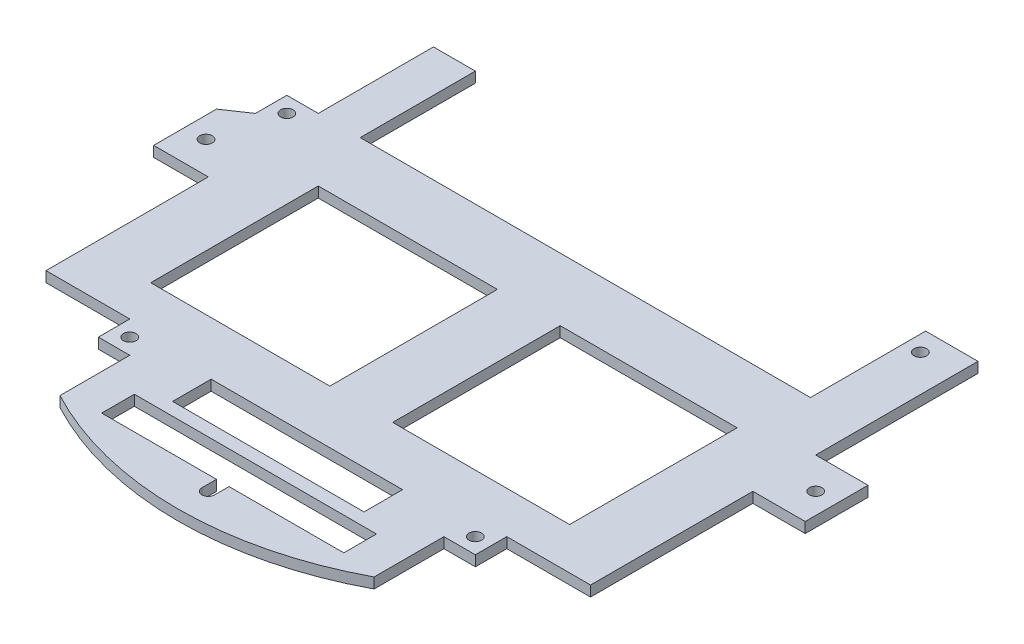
SolidWorks part; units mm, degrees
ref_plane "Ebene vorne" through (0, 0, 0) normal (0, 0, 1) x (1, 0, 0)
ref_plane "Ebene oben" through (0, 0, 0) normal (0, 1, 0) x (1, 0, 0)
ref_plane "Ebene rechts" through (0, 0, 0) normal (1, 0, 0) x (0, 0, -1)
sketch "Skizze1" plane through (0, 0, 0) normal (0, 1, 0) x (1, 0, 0)
  line L0 (-130, 92.5) -> (130, -92.5) construction
  line L1 (-130, 92.5) -> (-110, 92.5)
  line L2 (-130, 92.5) -> (-130, 37.5)
  line L3 (-130, -92.5) -> (-90, -92.5)
  line L4 (130, 92.5) -> (130, 41.1968)
  line L5 (105, 92.5) -> (130, 92.5)
  line L6 (-130, -92.5) -> (130, 92.5) construction
  line L7 (-110, 92.5) -> (-110, 62.6177)
  line L8 (-90, 37.5) -> (90, 37.5)
  line L9 (105, 92.5) -> (105, 57.5)
  line L10 (-130, 37.5) -> (-145, 37.5)
  line L11 (-110, 62.6177) -> (-110, 37.5)
  line L12 (-110, 37.5) -> (-90, 37.5)
  line L13 (45.7, -97.963) -> (-45.7, -97.963)
  line L14 (-75, -133.7259) -> (75, -133.7259) construction
  line L15 (105, 57.5) -> (105, 37.5)
  line L16 (105, 37.5) -> (90, 37.5)
  line L17 (15.5205, -72.5) -> (100, -72.5)
  line L18 (-3, -145.027) -> (-3, -138.1106)
  line L19 (-145, 37.5) -> (-145, 22.5)
  line L20 (155, -15) -> (155, 15)
  line L21 (-130, 22.5) -> (-145, 37.5) construction
  line L22 (-14.4795, 7.5) -> (-14.4795, -72.5)
  line L23 (15.5205, 7.5) -> (100, 7.5)
  line L24 (-130, -15) -> (-130, -92.5)
  line L25 (90, -92.5) -> (90, -107.5)
  line L26 (90, -107.5) -> (75, -107.5)
  line L27 (75, -140.8235) -> (75, -107.5)
  line L28 (90, -92.5) -> (130, -92.5)
  line L29 (-90, -92.5) -> (-90, -107.5)
  line L30 (-90, -107.5) -> (-75, -107.5)
  line L31 (-75, -140.8235) -> (-75, -107.5)
  line L32 (3, -145.027) -> (3, -138.1106)
  line L33 (15.5205, 7.5) -> (15.5205, -72.5)
  line L34 (75, -107.5) -> (90, -92.5) construction
  line L35 (-75, -107.5) -> (-90, -92.5) construction
  line L36 (130, -92.5) -> (130, -15)
  line L37 (-156.0879, -15) -> (-130, -15)
  line L38 (57.8, -122.5106) -> (-57.8, -122.5106)
  line L39 (-156.0879, -15) -> (-156.0879, 15)
  line L40 (3, -138.1106) -> (57.8, -138.1106)
  line L41 (130, 15) -> (130, 41.1968)
  line L42 (155, -15) -> (130, -15)
  line L43 (-156.0879, 15) -> (-145, 22.5)
  line L44 (155, 15) -> (130, 15)
  line L45 (-57.8, -122.5106) -> (-57.8, -138.1106)
  line L46 (0, 0) -> (169.2613, 0) construction
  line L47 (0, 0) -> (-130, 0) construction
  line L48 (-57.8, -138.1106) -> (-3, -138.1106)
  line L49 (-57.8, -138.1106) -> (57.8, -138.1106) construction
  line L53 (-100, 7.5) -> (-14.4795, 7.5)
  line L54 (-100, 7.5) -> (-100, -72.5)
  line L55 (-100, -72.5) -> (-14.4795, -72.5)
  line L56 (100, 7.5) -> (100, -72.5)
  line L57 (57.8, -138.1106) -> (57.8, -122.5106)
  line L59 (57.5, -122.8106) -> (-57.5, -122.8106)
  line L60 (-57.5, -122.8106) -> (-57.5, -137.8106)
  line L61 (-57.5, -137.8106) -> (57.5, -137.8106)
  line L62 (57.5, -137.8106) -> (57.5, -122.8106)
  line L63 (57.5, -122.8106) -> (-57.5, -122.8106) construction
  line L64 (-57.5, -122.8106) -> (-57.5, -137.8106) construction
  line L66 (57.5, -137.8106) -> (57.5, -122.8106) construction
  line L67 (-45.7, -97.963) -> (-45.7, -116.363)
  line L68 (-45.7, -116.363) -> (45.7, -116.363)
  line L69 (45.7, -116.363) -> (45.7, -97.963)
  line L70 (45, -98.663) -> (-45, -98.663)
  line L71 (-45, -98.663) -> (-45, -115.663)
  line L72 (-45, -115.663) -> (45, -115.663)
  line L73 (45, -115.663) -> (45, -98.663)
  line L74 (45, -98.663) -> (-45, -98.663) construction
  line L75 (-45, -98.663) -> (-45, -115.663) construction
  line L76 (-45, -115.663) -> (45, -115.663) construction
  line L77 (45, -115.663) -> (45, -98.663) construction
  line L78 (-57.5, -137.8106) -> (57.5, -137.8106) construction
  arc A0 (-75, -140.8235) -> (75, -140.8235) centre (0, 0) ccw
  circle A1 centre (-137.5, 30) radius 3
  circle A2 centre (112.5, 82.5) radius 3
  circle A3 centre (82.5, -100) radius 3
  circle A4 centre (-82.5, -100) radius 3
  circle A5 centre (-146.0879, 0) radius 3
  circle A6 centre (145, 0) radius 3
  arc A7 (130, -92.5) -> (-130, -92.5) centre (0, 0) ccw construction
  arc A8 (-3, -145.027) -> (3, -145.027) centre (0, -145.027) ccw
  point P43 (-141.9446, 0)
  point P58 (0, 17.5)
  point P64 (-156.0879, 0)
  dimension "D10" = 6
  dimension "D1" = 260
  dimension "D2" = 185
  dimension "D3" = 20
  dimension "D4" = 25
  dimension "D5" = 171.2259
  dimension "D6" = 0
  dimension "D7" = 0.7
  dimension "D8" = 0.3
  dimension "D9" = 15
  dimension "D11" = 30
  dimension "D12" = 0
  dimension "D13" = 30
  dimension "D14" = 30
  dimension "D15" = 55
  dimension "D16" = 7.5
  dimension "D17" = 10
  dimension "D18" = 25
  dimension "D19" = 30
  dimension "D21" = 30
extrude "Aufsatz-Linear austragen1" add sketch "Skizze1" along normal blind 5
